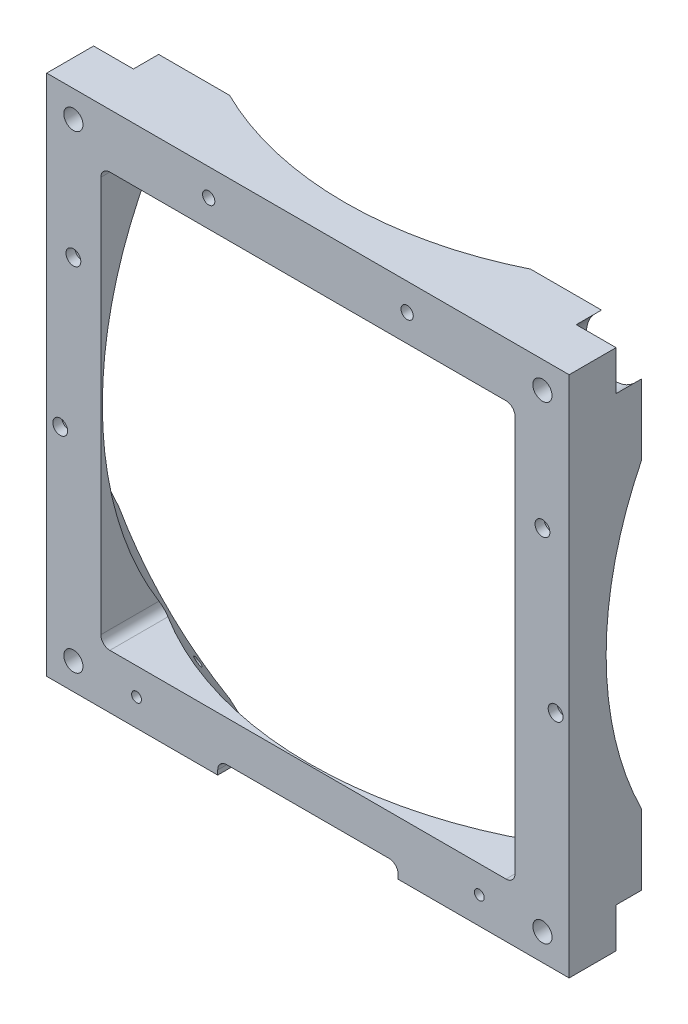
SolidWorks part; units mm, degrees
ref_plane "Front Plane" through (0, 0, 0) normal (0, 0, 1) x (1, 0, 0)
ref_plane "Top Plane" through (0, 0, 0) normal (0, 1, 0) x (1, 0, 0)
ref_plane "Right Plane" through (0, 0, 0) normal (1, 0, 0) x (0, 0, -1)
sketch "Sketch1" plane through (0, 0, 0) normal (0, 0, 1) x (1, 0, 0)
  line L3 (-91.948, -91.948) -> (-91.948, 91.948)
  line L9 (91.948, -91.948) -> (-91.948, -91.948)
  line L11 (-91.948, 91.948) -> (91.948, 91.948)
  line L12 (91.948, 91.948) -> (91.948, -91.948)
  line L18 (72.898, 72.898) -> (-72.898, 72.898)
  line L19 (-72.898, 72.898) -> (-72.898, -72.898)
  line L21 (-72.898, -72.898) -> (72.898, -72.898)
  line L23 (72.898, -72.898) -> (72.898, 72.898)
  circle A0 centre (0, 0) radius 116.7433 construction
  circle A3 centre (-82.55, 82.55) radius 3.3782
  circle A4 centre (82.55, -82.55) radius 3.3782
  circle A5 centre (82.55, 82.55) radius 3.3782
  circle A7 centre (-82.55, -82.55) radius 3.3782
  dimension "D6" = 72.898
  dimension "D7" = 82.55
  dimension "D9" = 6.7564
  dimension "D2" = 72.898
  dimension "D11" = 6.7564
  dimension "D12" = 165.1
  dimension "D13" = 82.55
  dimension "D14" = 6.7564
  dimension "D15" = 6.7564
  dimension "D16" = 165.1
  dimension "D18" = 165.1
  dimension "D19" = 233.4867
  dimension "D3" = 19.05
  dimension "D4" = 72.898
  dimension "D5" = 72.898
  dimension "D8" = 19.05
  dimension "D10" = 19.05
  dimension "D17" = 19.05
extrude "Extrude1" add sketch "Sketch1" along normal blind 25.4
ref_plane "Plane1" through (0, -46.8312, 0) normal (0, 1, 0) x (-1, 0, 0)
sketch "Sketch3" plane through (0, 73.0285, 0) normal (1, 0, 0) x (0, 1, 0)
  line L0 (-223.841, -107.1626) -> (77.784, -107.1626) construction
  line L1 (-223.841, -107.1626) -> (77.784, -107.1626)
  arc A0 (77.784, -107.1626) -> (-223.841, -107.1626) centre (-73.0285, -107.1626) ccw
  dimension "D1" = 301.625
  dimension "D2" = 107.1626
revolve "Cut-Revolve1" cut sketch "Sketch3" angle 360 about L0
sketch "Sketch50" plane through (0, 0, 0) normal (0, 0, -1) x (-1, 0, 0)
  line L0 (-124.5906, -110.5814) -> (-89.5546, -75.5454)
  line L1 (106.838, 92.8288) -> (89.5546, 75.5454)
  line L2 (-111.5898, 97.5806) -> (-89.5546, 75.5454)
  line L3 (111.6062, -97.597) -> (89.5546, -75.5454)
  line L4 (-96.1599, -110.1691) -> (-124.5906, -110.5814)
  line L5 (111.6062, -97.597) -> (89.0732, -103.0824)
  line L6 (106.838, 92.8288) -> (107.7009, 121.7101)
  line L7 (-94.8956, 108.9048) -> (-111.5898, 97.5806)
  line L9 (-75.5454, -89.5546) -> (-96.1599, -110.1691)
  line L10 (75.5454, -89.5546) -> (89.0732, -103.0824)
  line L13 (-75.5454, 89.5546) -> (-94.8956, 108.9048)
  line L14 (75.5454, 89.5546) -> (107.7009, 121.7101)
  arc A0 (89.5546, -75.5454) -> (75.5454, -89.5546) centre (82.55, -82.55) ccw
  arc A1 (-75.5454, -89.5546) -> (-89.5546, -75.5454) centre (-82.55, -82.55) ccw
  arc A2 (-89.5546, 75.5454) -> (-75.5454, 89.5546) centre (-82.55, 82.55) ccw
  arc A3 (75.5454, 89.5546) -> (89.5546, 75.5454) centre (82.55, 82.55) ccw
  dimension "D1" = 19.812
extrude "Extrude29" cut sketch "Sketch50" against normal blind 8.89
sketch "Sketch9" plane through (0, 0, 25.4) normal (0, 0, 1) x (1, 0, 0)
  line L0 (91.948, 91.948) -> (91.948, 80.9998)
  line L1 (91.948, 91.948) -> (80.9998, 91.948)
  line L3 (-84.1002, -91.948) -> (-91.948, -91.948)
  line L4 (-91.948, -91.948) -> (-91.948, -80.9998)
  line L5 (-91.948, 91.948) -> (-80.9998, 91.948)
  line L6 (91.948, -91.948) -> (91.948, -82.423)
  line L7 (-91.948, -91.948) -> (91.948, -91.948) construction
  line L8 (91.948, -91.948) -> (91.948, 91.948) construction
  line L9 (91.948, -91.948) -> (82.423, -91.948)
  line L15 (-91.948, 91.948) -> (-91.948, 80.9998)
  arc A0 (-84.1002, -91.948) -> (-91.948, -80.9998) centre (-82.55, -82.55) ccw
  arc A1 (91.948, -82.423) -> (82.423, -91.948) centre (82.423, -82.423) ccw
  arc A2 (-91.948, 80.9998) -> (-80.9998, 91.948) centre (-82.55, 82.55) ccw
  arc A5 (80.9998, 91.948) -> (91.948, 80.9998) centre (82.55, 82.55) ccw
  dimension "D1" = 9.525
  dimension "D2" = 9.525
  dimension "D3" = 19.05
  dimension "D4" = 19.05
sketch "Sketch313" plane through (0, 0, 0) normal (1, 0, 0) x (0, 0, -1)
  line L0 (107.1626, 134.6483) -> (107.1626, -71.5945) construction
  line L1 (0, 77.9388) -> (0, 52.9731) construction
  line L2 (0, 0) -> (107.1626, 0) construction
  arc A0 (11.7417, 114.7134) -> (20.418, -121.4072) centre (107.1626, 0) ccw
  dimension "D2" = 149.2124
  dimension "D1" = 107.1626
hole_wizard "#8-32 Tapped Hole1" positions "Sketch319" profile "Sketch318" tap size "#8-32" standard "Ansi Inch"
sketch "Sketch319" plane through (0, 0, 25.4) normal (0, 0, 1) x (1, 0, 0)
  line L0 (-72.898, -72.898) -> (72.898, -72.898) construction
  point P4 (60.325, -82.423)
  point P6 (-60.325, -82.423)
  dimension "D4" = 9.525
  dimension "D5" = 60.325
  dimension "D6" = 60.325
sketch "Sketch318" plane through (60.325, -82.423, 25.4) normal (1, 0, 0) x (0, -1, 0)
  line L0 (0, 0) -> (0, 25.4)
  line L1 (0, 25.4) -> (1.7272, 25.4)
  line L2 (1.7272, 25.4) -> (1.7272, 0)
  line L5 (1.7272, 0) -> (0, 0)
  line L11 (0, -6.35) -> (0, 107.95) construction
  dimension "Thru Tap Drill Dia." = 3.4544
  dimension "Thru Tap Drill Depth" = 25.4
sketch "Sketch320" plane through (0, -91.948, 0) normal (0, -1, 0) x (1, 0, 0)
  line L0 (0, -10.833) -> (0, 0) construction
  line L1 (-31.75, 49.2328) -> (31.75, 49.2328)
  line L2 (-31.75, 49.2328) -> (-31.75, -10.833)
  line L3 (-31.75, -10.833) -> (31.75, -10.833)
  line L4 (31.75, 49.2328) -> (31.75, -10.833)
  dimension "D1" = 63.5
extrude "Extrude30" cut sketch "Sketch320" against normal blind 4.7625
sketch "Sketch321" plane through (0, 0, 25.4) normal (0, 0, 1) x (1, 0, 0)
  line L2 (-91.948, -52.9731) -> (-91.948, -77.9388) construction
  line L3 (91.948, -77.9388) -> (91.948, -52.9731) construction
  circle A0 centre (-87.1855, -13.4937) radius 4.5644
  circle A1 centre (-82.55, 40.4812) radius 4.5644
  circle A2 centre (82.55, 40.4812) radius 4.5644
  circle A3 centre (87.1855, -13.4937) radius 4.5644
  point P8 (-87.1855, -13.4937)
  dimension "D5" = 9.1288
  dimension "D7" = 4.7625
  dimension "D6" = 4.7625
  dimension "D1" = 13.4937
  dimension "D2" = 40.4812
  dimension "D3" = 87.1855
  dimension "D4" = 87.1855
extrude "#10 SocHd" cut sketch "Sketch321" against normal blind 22.225 from offset 3.175
sketch "Sketch322" plane through (0, 0, 22.225) normal (0, 0, -1) x (-1, 0, 0)
  circle A0 centre (82.55, 40.4812) radius 2.6162
  circle A1 centre (87.1855, -13.4937) radius 2.6162
  circle A2 centre (-87.1855, -13.4937) radius 2.6162
  circle A3 centre (-82.55, 40.4812) radius 2.6162
  dimension "D1" = 5.2324
extrude "Cut-Extrude2" cut sketch "Sketch322" against normal through all
fillet "Fillet1" radius 3.175 6 edges at (31.75, -87.1855, 18.5641) (-31.75, -87.1855, 18.5641) (72.898, -72.898, 14.1554) (-72.898, -72.898, 14.1554) (-72.898, 72.898, 14.1554) (72.898, 72.898, 14.1554)
sketch "Sketch323" plane through (0, 0, 25.4) normal (0, 0, 1) x (1, 0, 0)
  line L0 (52.9731, 91.948) -> (-52.9731, 91.948) construction
  circle A0 centre (-34.925, 82.423) radius 2.159
  circle A1 centre (34.925, 82.423) radius 2.159
  dimension "D4" = 4.318
  dimension "D1" = 34.925
  dimension "D2" = 34.925
  dimension "D3" = 9.525
extrude "#6" cut sketch "Sketch323" against normal through all
sketch "Sketch324" plane through (0, 0, 25.4) normal (0, 0, 1) x (1, 0, 0)
  circle A0 centre (-34.925, 82.423) radius 3.5719
  circle A1 centre (34.925, 82.423) radius 3.5719
  dimension "D1" = 7.1437
extrude "#6 CntrBore" cut sketch "Sketch324" against normal blind 22.225 from offset 3.175
equation "\"Buoyancy\"=\"SW-Volume\"*(\"SW-Density\"-.037062)"
